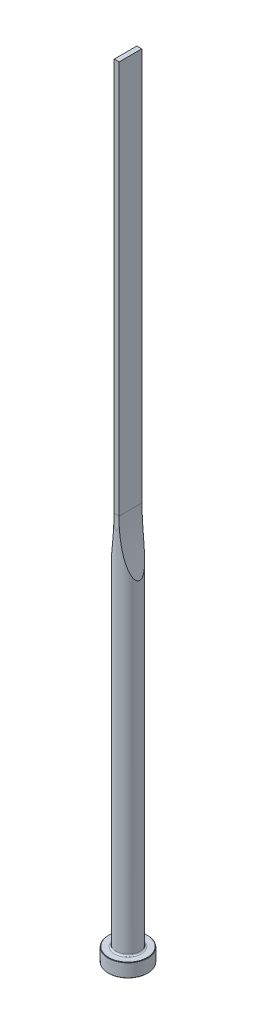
SolidWorks part; units mm, degrees
ref_plane "Front Plane" through (0, 0, 0) normal (0, 0, 1) x (1, 0, 0)
ref_plane "Top Plane" through (0, 0, 0) normal (0, 1, 0) x (1, 0, 0)
ref_plane "Right Plane" through (0, 0, 0) normal (1, 0, 0) x (0, 0, -1)
sketch "Sketch1" plane through (0, 0, 0) normal (0, 0, 1) x (1, 0, 0)
  line L0 (0, 0) -> (9.8, 0)
  line L1 (55, 0) -> (-55, 0) construction
  line L2 (10, 0.2) -> (10, 6.8)
  line L3 (9.8, 7) -> (6.8, 7)
  line L4 (6, 7.8) -> (6, 400)
  line L5 (0, 400) -> (6, 400)
  line L6 (10, 6.8) -> (9.8, 7)
  line L7 (9.8, 0) -> (10, 0.2)
  line L8 (0, 400) -> (0, 0)
  arc A0 (6, 7.8) -> (6.8, 7) centre (6.8, 7.8) ccw
  point P1 (10, 0)
  point P6 (10, 7)
  dimension "D4" = 0.8
  dimension "D1" = 6
  dimension "D2" = 10
  dimension "D3" = 7
  dimension "D5" = 400
revolve "Revolve1" add sketch "Sketch1" angle 360 about L8
sketch "Sketch2" plane through (0, 0, 0) normal (0, 0, 1) x (1, 0, 0)
  line L0 (1.25, 400) -> (1.25, 200)
  line L1 (6, 400) -> (-6, 400) construction
  line L2 (-1.25, 400) -> (-1.25, 200)
  line L3 (6, 400) -> (6, 171.148)
  line L4 (-6, 400) -> (-6, 171.148)
  line L5 (0, -11) -> (0, 11) construction
  line L6 (6, 400) -> (1.25, 400)
  line L8 (-1.25, 400) -> (-6, 400)
  arc A0 (1.25, 200) -> (6, 171.148) centre (91.25, 200) ccw
  arc A1 (-1.25, 200) -> (-6, 171.148) centre (-91.25, 200) cw
  dimension "D4" = 90
  dimension "D1" = 200
  dimension "D2" = 2.5
  dimension "D3" = 1.25
extrude "Cut-Extrude1" cut sketch "Sketch2" against normal mid plane 15
sketch "Sketch3" plane through (0, 0, 0) normal (1, 0, 0) x (0, 0, -1)
  line L0 (5.75, 400) -> (5.75, 200)
  line L1 (-5.8683, 400) -> (5.8683, 400) construction
  line L2 (-5.75, 400) -> (-5.75, 200)
  line L3 (6, 400) -> (6, 193.2965)
  line L4 (5.75, 400) -> (6, 400)
  line L5 (0, 11) -> (0, -11) construction
  line L6 (-6, 400) -> (-6, 193.2965)
  line L8 (-5.75, 400) -> (-6, 400)
  arc A0 (5.75, 200) -> (6, 193.2965) centre (95.75, 200) ccw
  arc A1 (-5.75, 200) -> (-6, 193.2965) centre (-95.75, 200) cw
  dimension "D2" = 90
  dimension "D1" = 200
  dimension "D3" = 11.5
  dimension "D4" = 5.75
extrude "Cut-Extrude2" cut sketch "Sketch3" against normal mid plane 15
